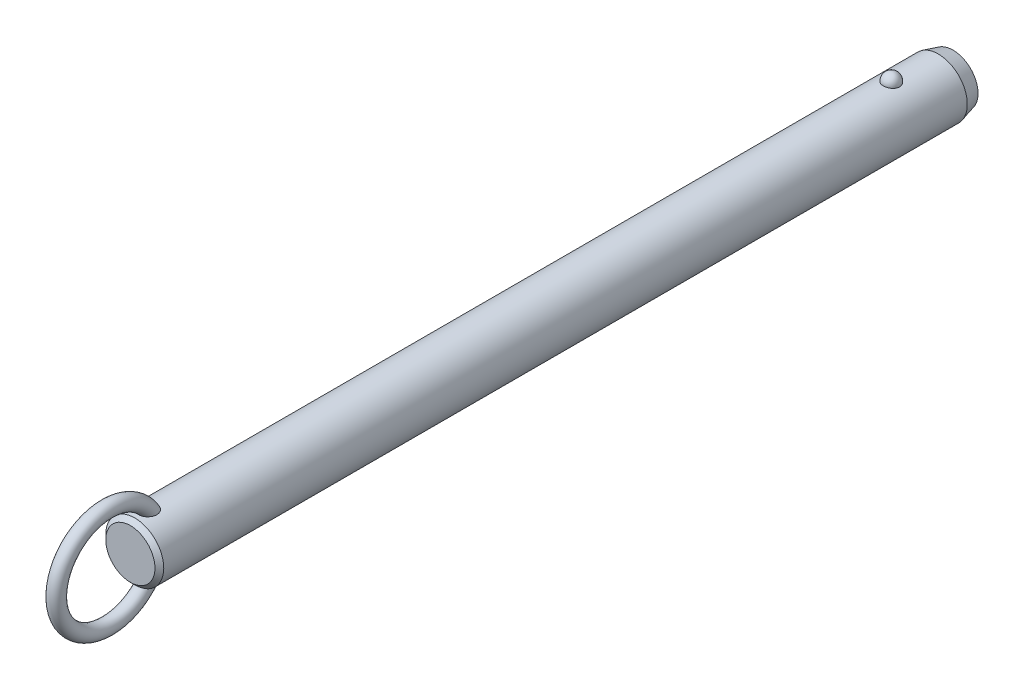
SolidWorks part; units mm, degrees
ref_plane "Front Plane" through (0, 0, 0) normal (0, 0, 1) x (1, 0, 0)
ref_plane "Top Plane" through (0, 0, 0) normal (0, 1, 0) x (1, 0, 0)
ref_plane "Right Plane" through (0, 0, 0) normal (1, 0, 0) x (0, 0, -1)
sketch "Sketch2" plane through (0, 0, 0) normal (0, 0, 1) x (1, 0, 0)
  circle A0 centre (0, 0) radius 7.9
  point P3 (0, 7.9)
  dimension "D1" = 15.8
extrude "Boss-Extrude1" add sketch "Sketch2" along normal blind 195.6
sketch "Sketch3" plane through (0, 0, 0) normal (0, 0, -1) x (-1, 0, 0)
  circle A0 centre (0, 0) radius 7.9
  dimension "D1" = 15.8
extrude "Boss-Extrude2" add sketch "Sketch3" along normal blind 19
chamfer "Chamfer1" distance 4 angle 15 1 edges at (-7.9, 0, -19)
sketch "Sketch12" plane through (0, 0, 0) normal (1, 0, 0) x (0, 0, -1)
  line L0 (-195.6, 7.9) -> (-195.6, -7.9) construction
  point P0 (-195.6, 0)
sketch "Sketch13" plane through (0, 0, 0) normal (1, 0, 0) x (0, 0, -1)
  circle A0 centre (-211.45, 0) radius 15.85
  point P2 (-195.6, 0)
  dimension "D1" = 31.7
sketch "Sketch14" plane through (0, 0, 0) normal (0, 1, 0) x (1, 0, 0)
  circle A0 centre (0, -197.6) radius 2
  point P2 (0, -195.6)
  dimension "D1" = 4
sweep "Sweep1" add profiles "Sketch14" path "Sketch13"
sketch "Sketch15" plane through (0, 0, 195.6) normal (0, 0, 1) x (1, 0, 0)
  circle A0 centre (0, 0) radius 7.9
  dimension "D1" = 15.8
extrude "Boss-Extrude3" add sketch "Sketch15" along normal blind 9.52
chamfer "Chamfer2" distance 1.2 angle 45 1 edges at (7.9, 0, 205.12)
sketch "Sketch18" plane through (0, 0, 0) normal (1, 0, 0) x (0, 0, -1)
  line L0 (15, 7.9) -> (-197.7091, 7.9) construction
  line L1 (2.2, 10.1) -> (2.2, 5.7)
  line L2 (-197.7091, -7.9) -> (15, -7.9) construction
  arc A0 (2.2, 10.1) -> (2.2, 5.7) centre (2.2, 7.9) ccw
  point P4 (0, 7.9)
  dimension "D1" = 18
revolve "Revolve1" add sketch "Sketch18" angle 360 about L1
